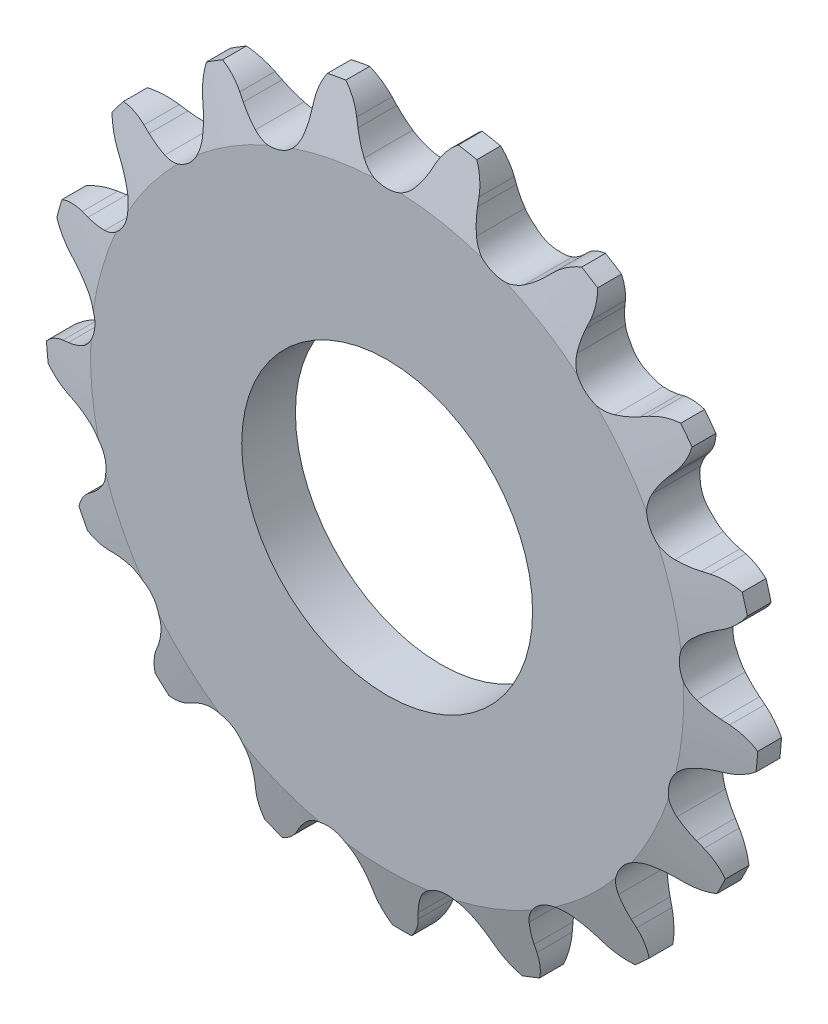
SolidWorks part; units mm, degrees
ref_plane "Front Plane" through (0, 0, 0) normal (0, 0, 1) x (1, 0, 0)
ref_plane "Top Plane" through (0, 0, 0) normal (0, 1, 0) x (1, 0, 0)
ref_plane "Right Plane" through (0, 0, 0) normal (1, 0, 0) x (0, 0, -1)
sketch "Sketch0" plane through (0, 0, 0) normal (0, 0, 1) x (1, 0, 0)
  line L0 (4.7625, -25.4771) -> (0, 0) construction
  line L1 (0, 0) -> (13.6443, -22.0363) construction
  line L2 (0, 0) -> (-4.7625, -25.4771) construction
  line L3 (4.7625, -25.4771) -> (13.6443, -22.0363) construction
  line L4 (4.7625, -25.4771) -> (-4.7625, -25.4771) construction
  line L5 (7.9299, -25.2811) -> (7.5928, -24.7889)
  line L6 (4.7625, -25.4771) -> (0, -26.3674) construction
  line L7 (1.7381, -26.4385) -> (1.8747, -25.8578)
  line L8 (0, -25.4771) -> (0, -28.3346) construction
  line L9 (6.4582, -23.5183) -> (2.1026, -28.5497) construction
  line L10 (0, 0) -> (0, -25.4771) construction
  line L11 (7.5928, -24.7889) -> (2.1026, -28.5497) construction
  line L12 (0, -28.3346) -> (0, -28.9575) construction
  line L13 (11.3942, -22.908) -> (7.9299, -25.2811) construction
  circle A0 centre (0, 0) radius 28.3346 construction
  circle A1 centre (0, 0) radius 25.9184 construction
  arc A2 (-2.7351, -29.6585) -> (13.2643, -26.6677) centre (0, 0) ccw
  circle A3 centre (0, 0) radius 28.9575 construction
  circle A4 centre (4.7625, -25.4771) radius 2.54 construction
  arc A7 (6.4582, -23.5183) -> (2.4737, -24.2632) centre (4.7625, -25.4771) ccw
  circle A8 centre (4.7625, -25.4771) radius 2.5908 construction
  arc A9 (7.9299, -25.2811) -> (13.2643, -26.6677) centre (11.3942, -22.908) ccw
  arc A10 (7.5928, -24.7889) -> (6.4582, -23.5183) centre (2.1026, -28.5497) ccw
  arc A11 (1.7381, -26.4385) -> (-2.7351, -29.6585) centre (-2.3495, -25.4771) cw
  arc A12 (1.8747, -25.8578) -> (2.4737, -24.2632) centre (8.3528, -27.3814) cw
  dimension "D1" = 2.5908
  dimension "Dr" = 5.08
  dimension "Ds" = 5.1816
  dimension "R" = 2.5908
  dimension "Pitch" = 9.525
  dimension "A" = 38.529
  dimension "360/N" = 21.176
  dimension "B" = 14.706
  dimension "ab" = 7.112
  dimension "J" = 2.8575
  dimension "ac" = 4.064
sketch "Sketch1" plane through (0, 0, 0) normal (1, 0, 0) x (0, 0, -1)
  line L0 (2.1336, 0) -> (-2.1336, 0)
  line L1 (-2.1336, 0) -> (-2.1336, 23.5721)
  line L2 (-2.1336, 23.5721) -> (-0.943, 28.3346)
  line L3 (-0.943, 28.3346) -> (0.943, 28.3346)
  line L4 (0.943, 28.3346) -> (2.1336, 23.5721)
  line L5 (2.1336, 23.5721) -> (2.1336, 0)
  line L7 (0, 28.3346) -> (0, 0) construction
  line L8 (-2.1336, 23.5721) -> (2.1336, 23.5721) construction
  line L9 (0, 28.3346) -> (0, -28.3346) construction
  line L10 (-2.1336, 23.5721) -> (-2.1336, 28.3346) construction
  line L11 (-2.1336, 28.3346) -> (-0.943, 28.3346) construction
  line L12 (0.943, 28.3346) -> (2.1336, 28.3346) construction
  line L13 (2.1336, 28.3346) -> (2.1336, 23.5721) construction
  dimension "t" = 4.2672
  dimension "g" = 1.1906
  dimension "h" = 4.7625
revolve "Revolve1" add sketch "Sketch1" angle 360 mid plane about L0
extrude "Cut-Extrude1" cut sketch "Sketch0" against normal through all and the other way through all
pattern_circular "CirPattern1" count 17 over 360 about axis through (0, 0, 0) along (0, 0, 1) of "Cut-Extrude1"
sketch "Sketch2" plane through (0, 0, 0) normal (0, 0, 1) x (1, 0, 0)
  circle A0 centre (0, 0) radius 6.35 construction
  circle A1 centre (0, 0) radius 30.1625
  circle A2 centre (0, 0) radius 28.321 construction
  dimension "Bore" = 12.7
  dimension "Hub Dia." = 60.325
  dimension "OD" = 56.642
sketch "Sketch3" plane through (0, 0, 0) normal (0, 0, 1) x (1, 0, 0)
  circle A0 centre (0, 0) radius 6.35 construction
  circle A1 centre (0, 0) radius 6.35
  circle A2 centre (0, 0) radius 28.321 construction
  circle A3 centre (0, 0) radius 28.321
extrude "Cut-Extrude2" cut sketch "Sketch3" along normal through all and the other way through all flip side to cut
sketch "Sketch4" plane through (0, 0, -2.1336) normal (0, 0, -1) x (-1, 0, 0)
  circle A0 centre (0, 0) radius 11.557
  dimension "D1" = 23.114
extrude "Cut-Extrude3" cut sketch "Sketch4" against normal through all
equation "\"360/N@Sketch0\" = 360/\"Teeth@CirPattern1\""
equation "\"Ds@Sketch0\" = 1.005 * \"Dr@Sketch0\" + 0.003"
equation "\"R@Sketch0\" = 1/2 * \"Ds@Sketch0\""
equation "\"A@Sketch0\" = 35 +  ( 60 / \"Teeth@CirPattern1\" ) "
equation "\"B@Sketch0\" = 18 -  ( 56 / \"Teeth@CirPattern1\" )"
equation "\"ac@Sketch0\" = 0.8 * \"Dr@Sketch0\""
equation "\"ab@Sketch0\" = 1.4 * \"Dr@Sketch0\""
equation "\"J@Sketch0\" = 0.3 * \"Pitch@Sketch0\""
equation "\"h@Sketch1\" = \"Pitch@Sketch0\" / 2"
equation "\"g@Sketch1\" = \"h@Sketch1\" / 4"
